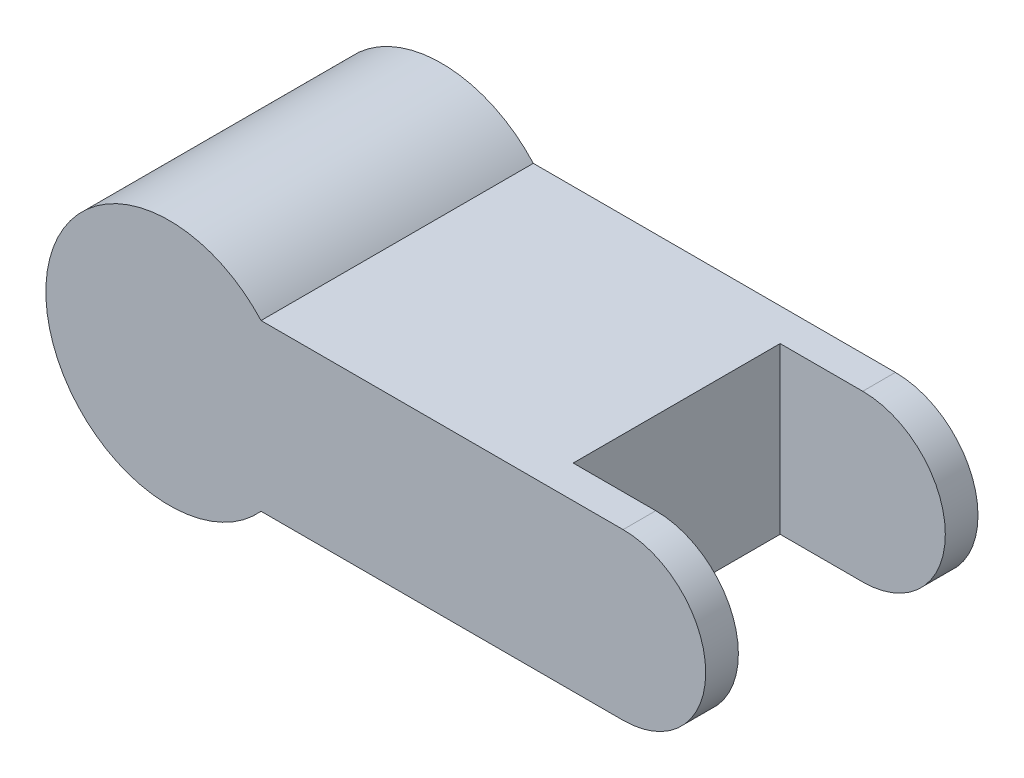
SolidWorks part; units mm, degrees
ref_plane "Front Plane" through (0, 0, 0) normal (0, 0, 1) x (1, 0, 0)
ref_plane "Top Plane" through (0, 0, 0) normal (0, 1, 0) x (1, 0, 0)
ref_plane "Right Plane" through (0, 0, 0) normal (1, 0, 0) x (0, 0, -1)
sketch "Sketch1" plane through (0, 0, 0) normal (0, 0, 1) x (1, 0, 0)
  line L0 (0, 158.2278) -> (0, 45.5) construction
  line L1 (0, -45.5) -> (0, -134.5973) construction
  line L2 (50.5346, -45.5) -> (250, -45.5)
  line L4 (50.5346, 45.5) -> (250, 45.5)
  arc A0 (50.5346, 45.5) -> (50.5346, -45.5) centre (0, 0) ccw
  arc A1 (250, -45.5) -> (250, 45.5) centre (250, 0) ccw
  dimension "D1" = 136
  dimension "D2" = 45.5
  dimension "D3" = 250
  dimension "D4" = 91
extrude "Boss-Extrude1" add sketch "Sketch1" against normal blind 150
sketch "Sketch2" plane through (0, 45.5, 0) normal (0, 1, 0) x (1, 0, 0)
  line L0 (295.5, 0) -> (295.5, 150) construction
  line L1 (295.5, 18) -> (204.5, 18)
  line L2 (295.5, 18) -> (295.5, 132)
  line L3 (295.5, 132) -> (204.5, 132)
  line L4 (204.5, 18) -> (204.5, 132)
  line L5 (295.5, 0) -> (295.5, 150) construction
  point P6 (295.5, 75)
  point P7 (295.5, 75)
  dimension "D1" = 91
  dimension "D2" = 114
extrude "Cut-Extrude1" cut sketch "Sketch2" against normal up to surface (91 mm away)
